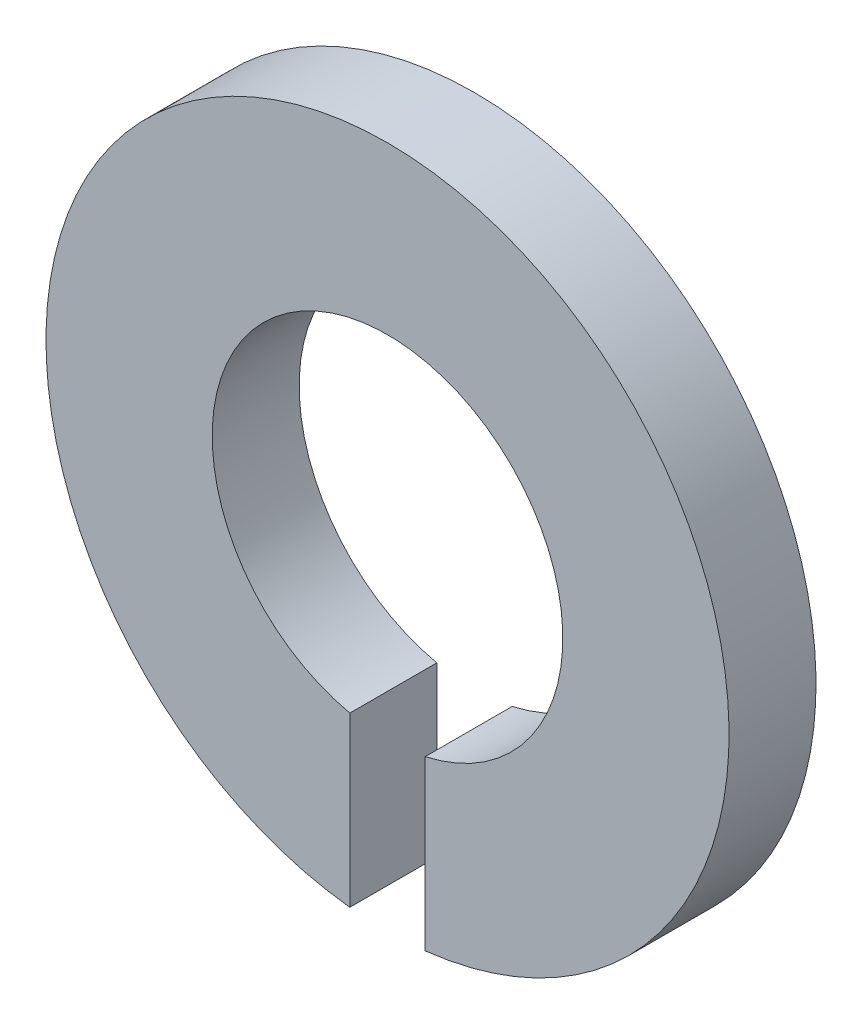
SolidWorks part; units mm, degrees
ref_plane "Front" through (0, 0, 0) normal (0, 0, 1) x (1, 0, 0)
ref_plane "Top" through (0, 0, 0) normal (0, 1, 0) x (1, 0, 0)
ref_plane "Right" through (0, 0, 0) normal (1, 0, 0) x (0, 0, -1)
sketch "Sketch1" plane through (0, 0, 0) normal (0, 0, 1) x (1, 0, 0)
  line L0 (-0.6828, -3.1007) -> (-0.6828, -6.1471)
  line L2 (0.6828, -3.1007) -> (0.6828, -6.1471)
  arc A0 (0.6828, -6.1471) -> (-0.6828, -6.1471) centre (0, 0) ccw
  arc A1 (0.6828, -3.1007) -> (-0.6828, -3.1007) centre (0, 0) ccw
  dimension "D1" = 12.3698
  dimension "D2" = 6.35
extrude "Extrude1" add sketch "Sketch1" along normal blind 1.5748
